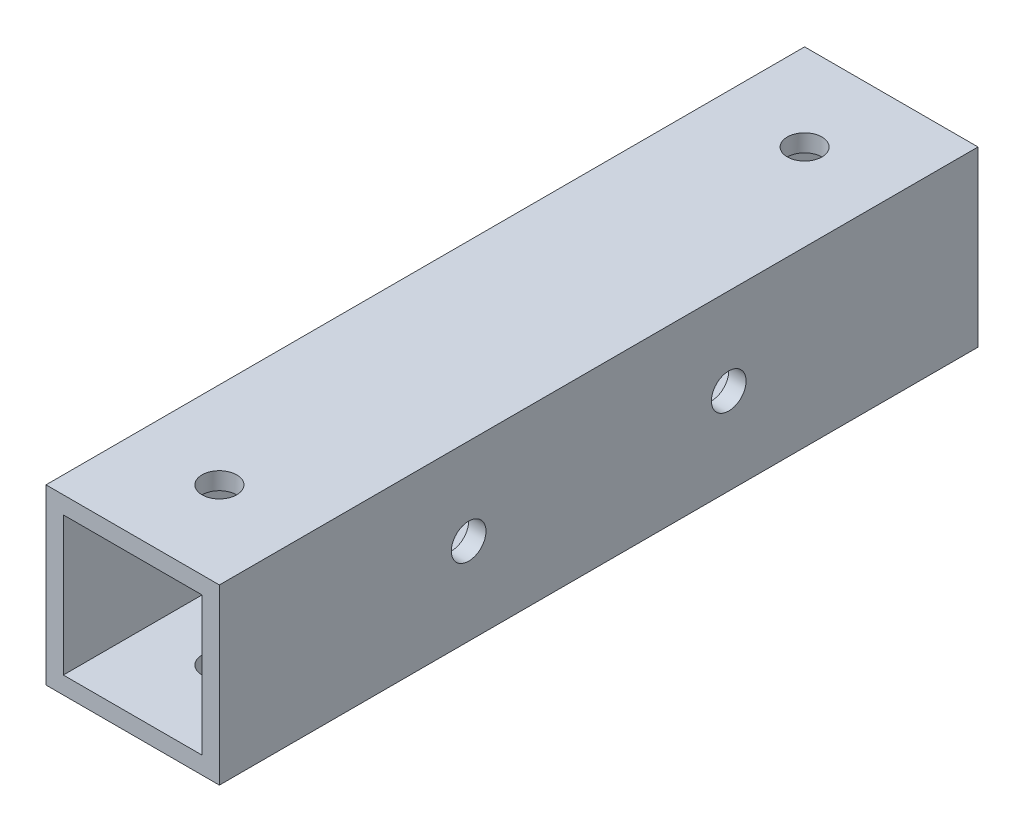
SolidWorks part; units mm, degrees
ref_plane "前视基准面" through (0, 0, 0) normal (0, 0, 1) x (1, 0, 0)
ref_plane "上视基准面" through (0, 0, 0) normal (0, 1, 0) x (1, 0, 0)
ref_plane "右视基准面" through (0, 0, 0) normal (1, 0, 0) x (0, 0, -1)
sketch "草图1" plane through (0, 0, 0) normal (0, 0, 1) x (1, 0, 0)
  line L0 (-8, 8) -> (8, 8)
  line L1 (-10, 10) -> (10, 10)
  line L2 (-10, 10) -> (-10, -10)
  line L3 (-10, -10) -> (10, -10)
  line L4 (10, 10) -> (10, -10)
  line L5 (-10, 10) -> (10, -10) construction
  line L6 (-10, -10) -> (10, 10) construction
  line L7 (8, 8) -> (8, -8)
  line L8 (-8, -8) -> (8, -8)
  line L9 (-8, 8) -> (-8, -8)
  point P0 (0, 0)
  dimension "D1" = 20
  dimension "D2" = 20
  dimension "D3" = 2
extrude "凸台-拉伸1" add sketch "草图1" along normal blind 87.5
hole_wizard "Ø4.0 (4) 直径孔1" positions "草图2" profile "草图3" hole size "Ø4.0" standard "GB"
sketch "草图2" plane through (0, 10, 0) normal (0, 1, 0) x (1, 0, 0)
  point P0 (0, -10)
  point P2 (0, -77.5)
  point P5 (0, -10)
  point P7 (0, -77.5)
sketch "草图3" plane through (0, 10, 10) normal (1, 0, 0) x (0, 0, 1)
  line L0 (0, 0) -> (0, 20)
  line L1 (0, 20) -> (2, 20)
  line L2 (2, 20) -> (2, 0)
  line L5 (2, 0) -> (0, 0)
  line L11 (0, -6.35) -> (0, 107.95) construction
  dimension "通孔孔直径" = 4
  dimension "通孔孔深度" = 20
hole_wizard "Ø4.0 (4) 直径孔2" positions "草图4" profile "草图5" hole size "Ø4.0" standard "GB"
sketch "草图4" plane through (10, 0, 0) normal (1, 0, 0) x (0, 0, -1)
  line L0 (-87.5, 10) -> (0, 10) construction
  point P0 (-58.75, 0)
  point P2 (-28.75, 0)
  point P7 (-43.75, 10)
  dimension "D1" = 30
  dimension "D2" = 15
  dimension "D3" = 10
sketch "草图5" plane through (10, 0, 58.75) normal (0, 1, 0) x (0, 0, -1)
  line L0 (0, 0) -> (0, 20)
  line L1 (0, 20) -> (2, 20)
  line L2 (2, 20) -> (2, 0)
  line L5 (2, 0) -> (0, 0)
  line L11 (0, -6.35) -> (0, 107.95) construction
  dimension "通孔孔直径" = 4
  dimension "通孔孔深度" = 20
